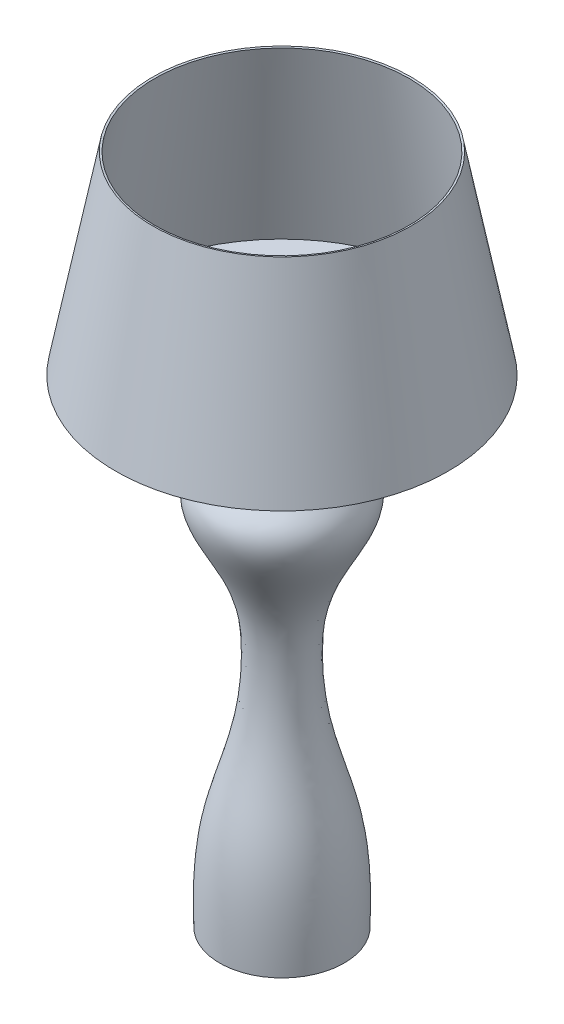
SolidWorks part; units mm, degrees
ref_plane "Płaszczyzna przednia" through (0, 0, 0) normal (0, 0, 1) x (1, 0, 0)
ref_plane "Płaszczyzna górna" through (0, 0, 0) normal (0, 1, 0) x (1, 0, 0)
ref_plane "Płaszczyzna prawa" through (0, 0, 0) normal (1, 0, 0) x (0, 0, -1)
sketch "Szkic1" plane through (0, 0, 0) normal (0, 0, 1) x (1, 0, 0)
  line L0 (456.7464, 913.4928) -> (2283.7321, 913.4928) construction
  line L1 (1572.9718, 226.3302) -> (1476.4718, 226.3302)
  line L2 (1521.4718, 926.3302) -> (1565.4718, 926.3302)
  line L3 (1565.4718, 926.3302) -> (1565.4718, 966.3302)
  line L4 (1565.4718, 966.3302) -> (1315.4718, 966.3302)
  line L5 (1315.4718, 966.3302) -> (1372.9718, 1266.3302)
  line L6 (1572.9718, 226.3302) -> (1572.9718, 1275.0865) construction
  spline S0 degree 3 poles (1476.4718, 226.3302) (1473.891, 314.0745) (1488.3878, 407.957) (1534.2974, 526.0951) (1521.4334, 721.6369) (1403.0628, 816.885) (1530.9552, 882.7135) (1521.4718, 926.3302) knots 0 0 0 0 0.246687 0.520734 0.580528 0.844623 1 1 1 1
  dimension "D4" = 44
  dimension "D1" = 105
  dimension "D2" = 700
  dimension "D3" = 96.5
  dimension "D5" = 15
  dimension "D6" = 250
  dimension "D7" = 200
  dimension "D8" = 300
  dimension "D9" = 40
revolve "Obrót-cienka ścianka1" add sketch "Szkic1" angle 360 about L6
